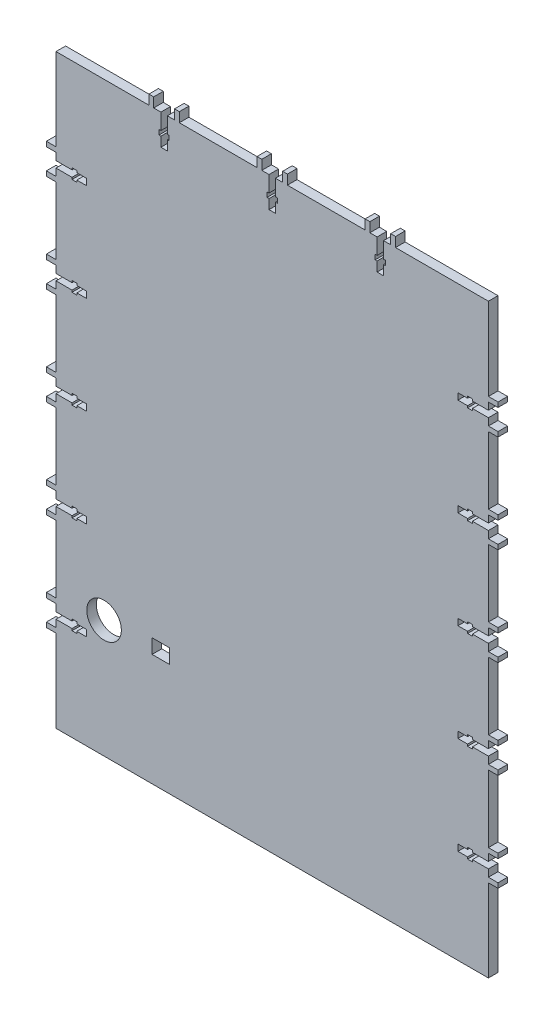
SolidWorks part; units mm, degrees
ref_plane "Front Plane" through (0, 0, 0) normal (0, 0, 1) x (1, 0, 0)
ref_plane "Top Plane" through (0, 0, 0) normal (0, 1, 0) x (1, 0, 0)
ref_plane "Right Plane" through (0, 0, 0) normal (1, 0, 0) x (0, 0, -1)
sketch "Sketch1" plane through (0, 0, 0) normal (0, 0, 1) x (1, 0, 0)
  line L1 (-135, -183) -> (135, -183)
  line L2 (-135, -183) -> (-135, 183)
  line L3 (-135, 183) -> (135, 183)
  line L4 (135, -183) -> (135, 183)
  line L5 (-135, -183) -> (135, 183) construction
  line L6 (-135, 183) -> (135, -183) construction
  point P0 (0, 0)
  dimension "D1" = 366
  dimension "D2" = 270
extrude "Boss-Extrude1" add sketch "Sketch1" along normal blind 6
sketch "Sketch2" plane through (0, 0, 6) normal (0, 0, 1) x (1, 0, 0)
  line L0 (-135, -183) -> (135, -183) construction
  line L1 (-75, -104) -> (-64, -104)
  line L2 (-75, -104) -> (-75, -113)
  line L3 (-75, -113) -> (-64, -113)
  line L4 (-64, -104) -> (-64, -113)
  line L5 (-75, -104) -> (-64, -113) construction
  line L6 (-75, -113) -> (-64, -104) construction
  line L7 (-135, 183) -> (-135, -183) construction
  circle A0 centre (-105, -109.5) radius 10.8
  point P0 (-69.5, -108.5)
  dimension "D5" = 21.6
  dimension "D7" = 30
  dimension "D1" = 11
  dimension "D2" = 9
  dimension "D3" = 70
  dimension "D4" = 60
  dimension "D6" = 73.5
extrude "Cut-Extrude1" cut sketch "Sketch2" against normal through all
sketch "Sketch3" plane through (0, 0, 6) normal (0, 0, 1) x (1, 0, 0)
  line L0 (-69.5, 183) -> (-69.5, 173)
  line L1 (135, 183) -> (-135, 183) construction
  line L2 (-69.5, 173) -> (-70.7, 173)
  line L3 (-70.7, 173) -> (-70.7, 170)
  line L4 (-70.7, 170) -> (-69.5, 170)
  line L5 (-69.5, 170) -> (-69.5, 164)
  line L6 (-69.5, 164) -> (-65.5, 164)
  line L7 (-65.5, 164) -> (-65.5, 170)
  line L8 (-65.5, 170) -> (-64.3, 170)
  line L9 (-64.3, 170) -> (-64.3, 173)
  line L10 (-64.3, 173) -> (-65.5, 173)
  line L11 (-65.5, 173) -> (-65.5, 183)
  line L12 (-65.5, 183) -> (-69.5, 183)
  line L13 (-135, 183) -> (-135, -183) construction
  point P8 (-67.5, 183)
  dimension "D1" = 4
  dimension "D2" = 3
  dimension "D3" = 10
  dimension "D4" = 6
  dimension "D5" = 6.4
  dimension "D6" = 67.5
extrude "Cut-Extrude2" cut sketch "Sketch3" against normal through all
sketch "Sketch4" plane through (0, 0, 6) normal (0, 0, 1) x (1, 0, 0)
  line L0 (-69.5, 183) -> (-135, 183) construction
  line L1 (-77, 183) -> (-74, 183)
  line L2 (-77, 183) -> (-77, 189)
  line L3 (-77, 189) -> (-74, 189)
  line L4 (-74, 183) -> (-74, 189)
  line L5 (-69.5, 164) -> (-65.5, 164) construction
  line L6 (-67.5, 164) -> (-67.5, 183) construction
  line L7 (-67.5, 183) -> (-69.5, 183) construction
  line L8 (-58, 189) -> (-61, 189)
  line L9 (-61, 183) -> (-61, 189)
  line L10 (-58, 183) -> (-61, 183)
  line L11 (-58, 183) -> (-58, 189)
  point P8 (-67.5, 164)
  point P9 (-75.5, 189)
  dimension "D1" = 3
  dimension "D2" = 6
  dimension "D3" = 8
extrude "Boss-Extrude2" add sketch "Sketch4" against normal through all
pattern_linear "LPattern1" count 3 spacing 67.5 along (1, 0, 0) of "Boss-Extrude2", "Cut-Extrude2"
sketch "Sketch5" plane through (0, 0, 6) normal (0, 0, 1) x (1, 0, 0)
  line L0 (-135, 124) -> (-125, 124)
  line L1 (-135, 183) -> (-135, -183) construction
  line L2 (-125, 124) -> (-125, 125.2)
  line L3 (-125, 125.2) -> (-122, 125.2)
  line L4 (-122, 125.2) -> (-122, 124)
  line L5 (-122, 124) -> (-116, 124)
  line L6 (-116, 124) -> (-116, 120)
  line L7 (-116, 120) -> (-122, 120)
  line L8 (-122, 120) -> (-122, 118.8)
  line L9 (-122, 118.8) -> (-125, 118.8)
  line L10 (-125, 118.8) -> (-125, 120)
  line L11 (-125, 120) -> (-135, 120)
  line L12 (-135, 120) -> (-135, 124)
  line L13 (-77, 183) -> (-135, 183) construction
  line L14 (-135, 183) -> (-135, -183) construction
  point P14 (-135, 122)
extrude "Cut-Extrude3" cut sketch "Sketch5" against normal through all
sketch "Sketch6" plane through (0, 0, 6) normal (0, 0, 1) x (1, 0, 0)
  line L0 (-135, 183) -> (-135, 124) construction
  line L1 (-135, 128.5) -> (-141, 128.5)
  line L2 (-135, 128.5) -> (-135, 131.5)
  line L3 (-135, 131.5) -> (-141, 131.5)
  line L4 (-141, 128.5) -> (-141, 131.5)
  line L5 (-116, 120) -> (-116, 124) construction
  line L6 (-116, 122) -> (-135, 122) construction
  line L7 (-135, 122) -> (-135, 124) construction
  line L8 (-135, 112.5) -> (-141, 112.5)
  line L9 (-141, 115.5) -> (-141, 112.5)
  line L10 (-135, 115.5) -> (-141, 115.5)
  line L11 (-135, 115.5) -> (-135, 112.5)
  point P6 (-141, 130)
  point P9 (-116, 122)
  dimension "D1" = 6
  dimension "D2" = 3
  dimension "D3" = 8
extrude "Boss-Extrude3" add sketch "Sketch6" against normal through all
pattern_linear "LPattern2" count 5 spacing 61 along (0, -1, 0) of "Boss-Extrude3", "Cut-Extrude3"
mirror "Mirror1" about plane through (0, 0, 0) normal (1, 0, 0) of "LPattern2", "Cut-Extrude3", "Boss-Extrude3"
equation "\"D5@Sketch5\"=\"D6@Sketch5\"/6"
